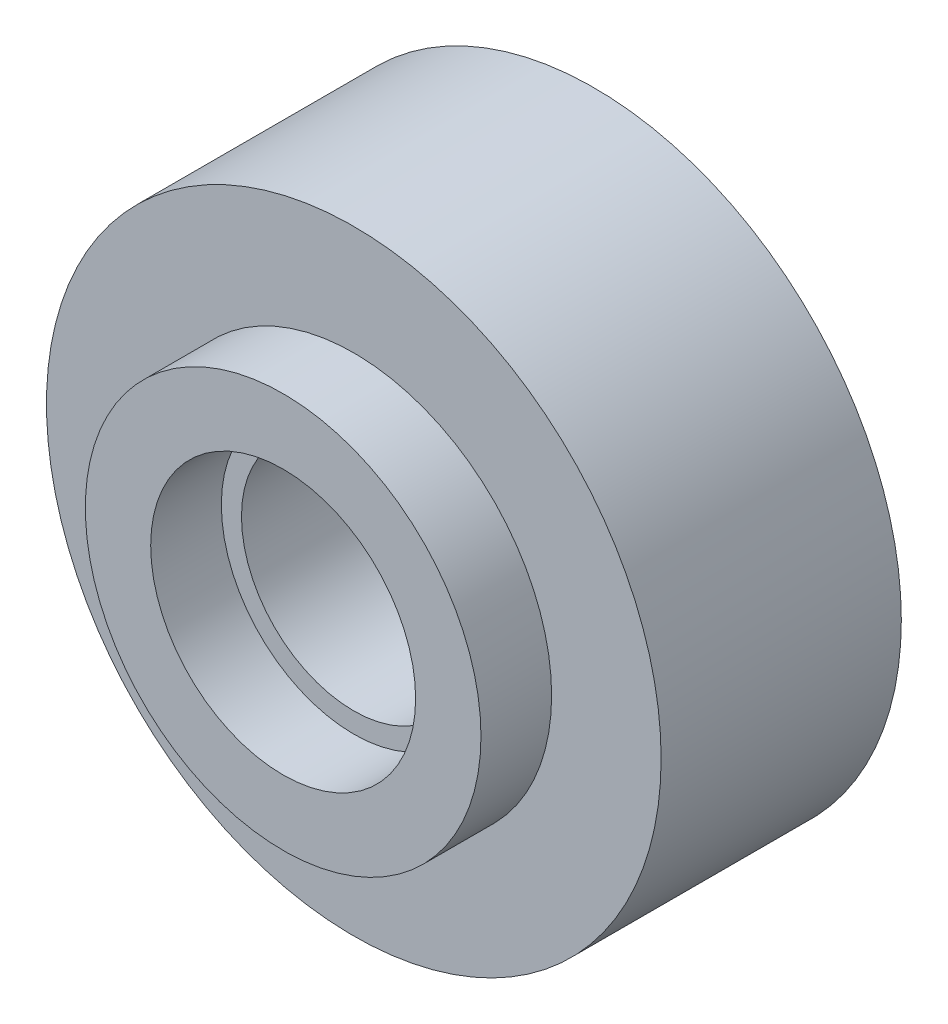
SolidWorks part; units mm, degrees
ref_plane "Front Plane" through (0, 0, 0) normal (0, 0, 1) x (1, 0, 0)
ref_plane "Top Plane" through (0, 0, 0) normal (0, 1, 0) x (1, 0, 0)
ref_plane "Right Plane" through (0, 0, 0) normal (1, 0, 0) x (0, 0, -1)
sketch "Sketch1" plane through (0, 0, 0) normal (0, 0, 1) x (1, 0, 0)
  circle A0 centre (0, 0) radius 5.5245
  dimension "D1" = 11.049
extrude "base" add sketch "Sketch1" along normal blind 5.588
sketch "Sketch2" plane through (0, 0, 5.588) normal (0, 0, 1) x (1, 0, 0)
  circle A0 centre (0, 0) radius 2.3813
  dimension "D1" = 4.7625
extrude "vent_area" cut sketch "Sketch2" against normal blind 1.27
sketch "Sketch3" plane through (0, 0, 5.588) normal (0, 0, 1) x (1, 0, 0)
  circle A0 centre (0, 0) radius 3.556
  dimension "D1" = 7.112
extrude "oring_groove" cut sketch "Sketch3" against normal blind 1.27 flip side to cut
sketch "Sketch4" plane through (0, 0, 0) normal (0, 0, -1) x (-1, 0, 0)
  circle A0 centre (0, 0) radius 2.0193
  dimension "D1" = 4.0386
extrude "thru_hole" cut sketch "Sketch4" against normal through all
